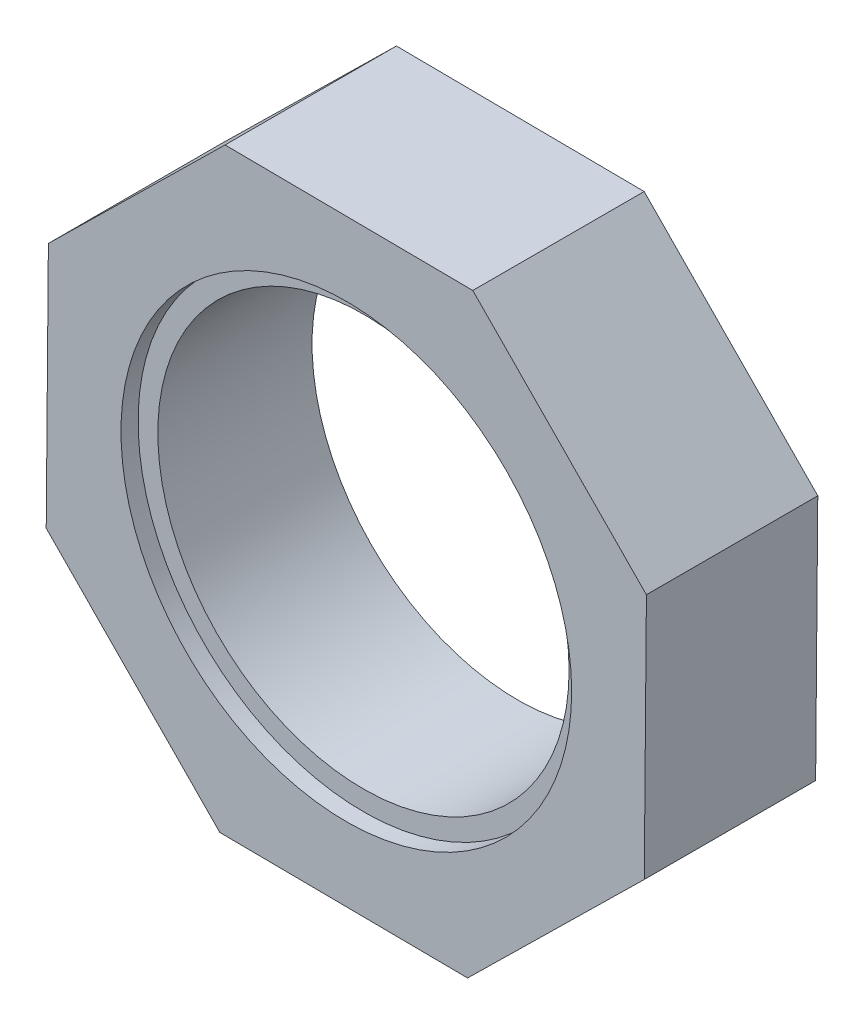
SolidWorks part; units mm, degrees
ref_plane "Plan de face" through (0, 0, 0) normal (0, 0, 1) x (1, 0, 0)
ref_plane "Plan de dessus" through (0, 0, 0) normal (0, 1, 0) x (1, 0, 0)
ref_plane "Plan de droite" through (0, 0, 0) normal (1, 0, 0) x (0, 0, -1)
sketch "Esquisse4" plane through (0, 0, 0) normal (0, 0, 1) x (1, 0, 0)
  line L1 (17.5124, 7.0755) -> (7.38, 17.3863)
  line L2 (7.38, 17.3863) -> (-7.0755, 17.5124)
  line L3 (-7.0755, 17.5124) -> (-17.3863, 7.38)
  line L4 (-17.3863, 7.38) -> (-17.5124, -7.0755)
  line L5 (-17.5124, -7.0755) -> (-7.38, -17.3863)
  line L6 (-7.38, -17.3863) -> (7.0755, -17.5124)
  line L7 (7.0755, -17.5124) -> (17.3863, -7.38)
  line L8 (17.3863, -7.38) -> (17.5124, 7.0755)
  circle A0 centre (0, 0) radius 17.45 construction
  dimension "D1" = 34.9
extrude "Boss.-Extru.2" add sketch "Esquisse4" along normal blind 10
sketch "Esquisse5" plane through (0, 0, 10) normal (0, 0, 1) x (1, 0, 0)
  circle A0 centre (0, 0) radius 12
extrude "Enlèv. mat.-Extru.2" cut sketch "Esquisse5" against normal through all contours A0
sketch "Esquisse6" plane through (0, 0, 10) normal (0, 0, 1) x (1, 0, 0)
  circle A0 centre (0, 0) radius 13.15
extrude "Enlèv. mat.-Extru.3" cut sketch "Esquisse6" against normal blind 1
